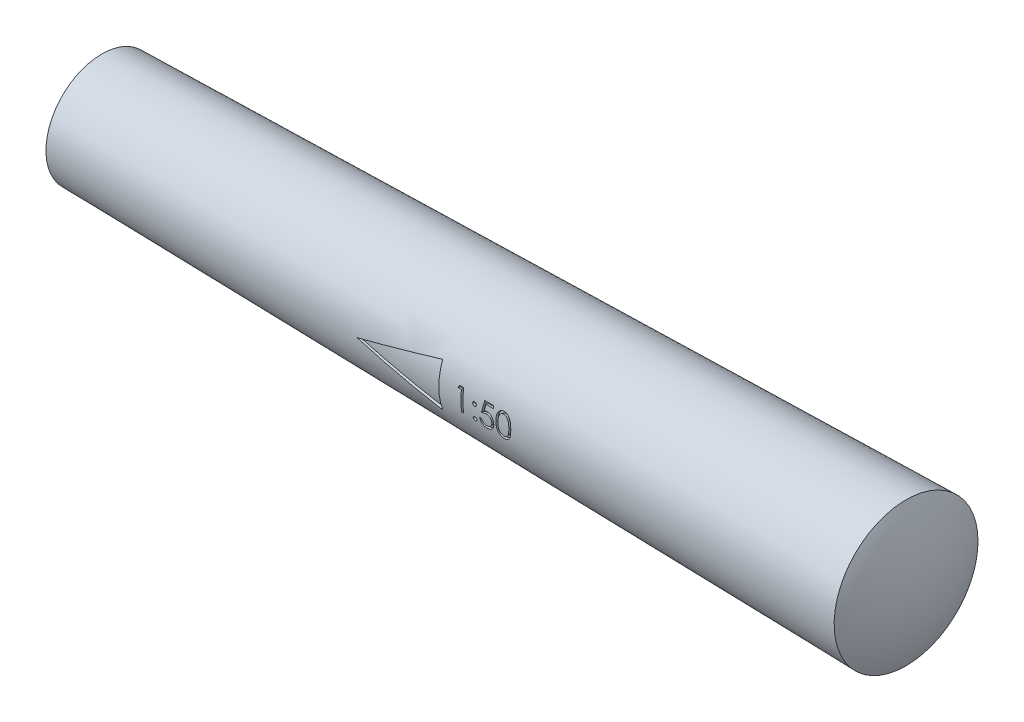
SolidWorks part; units mm, degrees
ref_plane "Front Plane" through (0, 0, 0) normal (0, 0, 1) x (1, 0, 0)
ref_plane "Top Plane" through (0, 0, 0) normal (0, 1, 0) x (1, 0, 0)
ref_plane "Right Plane" through (0, 0, 0) normal (1, 0, 0) x (0, 0, -1)
sketch "Sketch1" plane through (0, 0, 0) normal (1, 0, 0) x (0, 0, -1)
  circle A0 centre (0, 0) radius 2.5
  dimension "D1" = 5
extrude "Extrude1" add sketch "Sketch1" along normal mid plane 36
draft "Draft1" type of draft neutral plane draft angle 1.146 faces to draft 1 parameters "D1"=1.146
sketch "Sketch2" plane through (0, 0, 0) normal (0, 0, 1) x (1, 0, 0)
  line L0 (-18, 0) -> (-18, 2.5)
  line L1 (-18, 2.5) -> (-18, -2.5) construction
  line L2 (-18, 0) -> (-18.75, 0)
  line L3 (-18.75, 0) -> (-18.75, -2.86) construction
  line L4 (18, 0) -> (18, 3.22)
  line L5 (18, -3.22) -> (18, 3.22) construction
  line L6 (18, 0) -> (18.75, 0)
  line L7 (18.75, 0) -> (18.75, -2.86) construction
  line L8 (-18, -2.5) -> (18, -3.22) construction
  arc A0 (-18.75, 0) -> (-18, 2.5) centre (-14.2083, 0) cw
  arc A1 (18.75, 0) -> (18, 3.22) centre (11.4626, 0) ccw
  point P14 (0, -2.86)
revolve "Revolve1" add sketch "Sketch2" angle 360 about L2
sketch "Sketch5" plane through (0, 0, 0) normal (0, 0, 1) x (1, 0, 0)
  line L0 (0, 2.86) -> (0, -2.86) construction
  line L1 (18, 3.22) -> (-18, 2.5) construction
  line L2 (-18, -2.5) -> (18, -3.22) construction
ref_plane "Plane2" through (0, 0, 0) normal (-0.02, 0, 0.9998) x (0.9998, 0, 0.02)
sketch "Sketch6" plane through (0, 0, 0) normal (-0.02, 0, 0.9998) x (0.9998, 0, 0.02)
  line L0 (0, 0) -> (0, 1)
  line L1 (0, 2.86) -> (0, -2.86) construction
  line L2 (0, 1) -> (-3.7321, 0)
  line L3 (-3.7321, 0) -> (0, -1)
  line L4 (0, -1) -> (0, 0)
  line L5 (0, -0.5) -> (4, -0.5) construction
  text T0 "1:50" font "Century Gothic" height 1
  dimension "D1" = 2
  dimension "D2" = 30
  dimension "D3" = 4
wrap "Wrap2" sketch "Sketch6" wrap type deboss source sketch "Sketch6" thickness 0.1 parameters "D1"=0.1
equation "\"D2@Sketch2\" = \"D1@Sketch2\""
